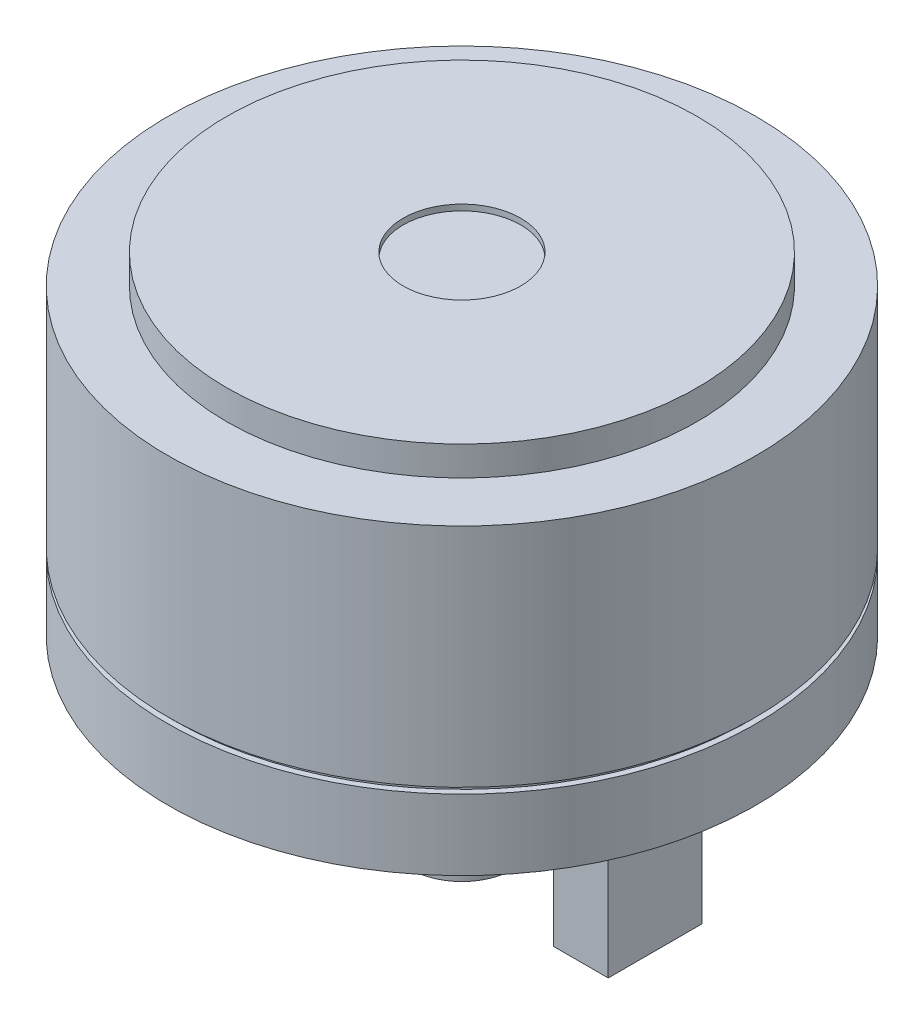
SolidWorks part; units mm, degrees
ref_plane "Front Plane" through (0, 0, 0) normal (0, 0, 1) x (1, 0, 0)
ref_plane "Top Plane" through (0, 0, 0) normal (0, 1, 0) x (1, 0, 0)
ref_plane "Right Plane" through (0, 0, 0) normal (1, 0, 0) x (0, 0, -1)
sketch "Sketch1" plane through (0, 0, 0) normal (1, 0, 0) x (0, 0, -1)
  line L0 (0, 0) -> (0, 5.55) construction
  line L1 (0, 5.55) -> (1, 5.55)
  line L2 (1, 5.55) -> (1, 5.65)
  line L3 (1, 5.65) -> (4, 5.65)
  line L4 (4, 5.65) -> (4, 5.15)
  line L5 (4, 5.15) -> (5, 5.15)
  line L6 (5, 5.15) -> (5, 1.3)
  line L7 (5, 1.3) -> (4.9, 1.3)
  line L8 (4.9, 1.3) -> (4.9, 1.2)
  line L9 (4.9, 1.2) -> (5, 1.2)
  line L10 (5, 1.2) -> (5, 0)
  line L11 (5, 0) -> (0, 0)
  line L12 (0, 0) -> (0, 5.55)
  dimension "D1" = 10
  dimension "D2" = 8
  dimension "D3" = 5.65
  dimension "D4" = 0.5
  dimension "D5" = 1.2
  dimension "D6" = 0.1
  dimension "D7" = 0.1
  dimension "D8" = 0.1
  dimension "D9" = 0.1
  dimension "D10" = 2
revolve "Revolve1" add sketch "Sketch1" angle 360 about L0
sketch "Sketch2" plane through (0, 0, 0) normal (0, -1, 0) x (1, 0, 0)
  line L0 (0, 5) -> (0, -5) construction
  line L1 (-3.2874, 0.7989) -> (-2.353, 0.7989)
  line L2 (-3.2874, 0.7989) -> (-3.2874, -0.7989)
  line L3 (-3.2874, -0.7989) -> (-2.353, -0.7989)
  line L4 (-2.353, 0.7989) -> (-2.353, -0.7989)
  line L5 (2.353, 0.7989) -> (3.2874, 0.7989)
  line L6 (2.353, 0.7989) -> (2.353, -0.7989)
  line L7 (2.353, -0.7989) -> (3.2874, -0.7989)
  line L8 (3.2874, 0.7989) -> (3.2874, -0.7989)
  circle A0 centre (0, 0) radius 0.8812
  circle A1 centre (0, 0) radius 5 construction
  point P11 (-2.353, 0)
  point P12 (2.353, 0)
extrude "Boss-Extrude1" add sketch "Sketch2" along normal blind 3
